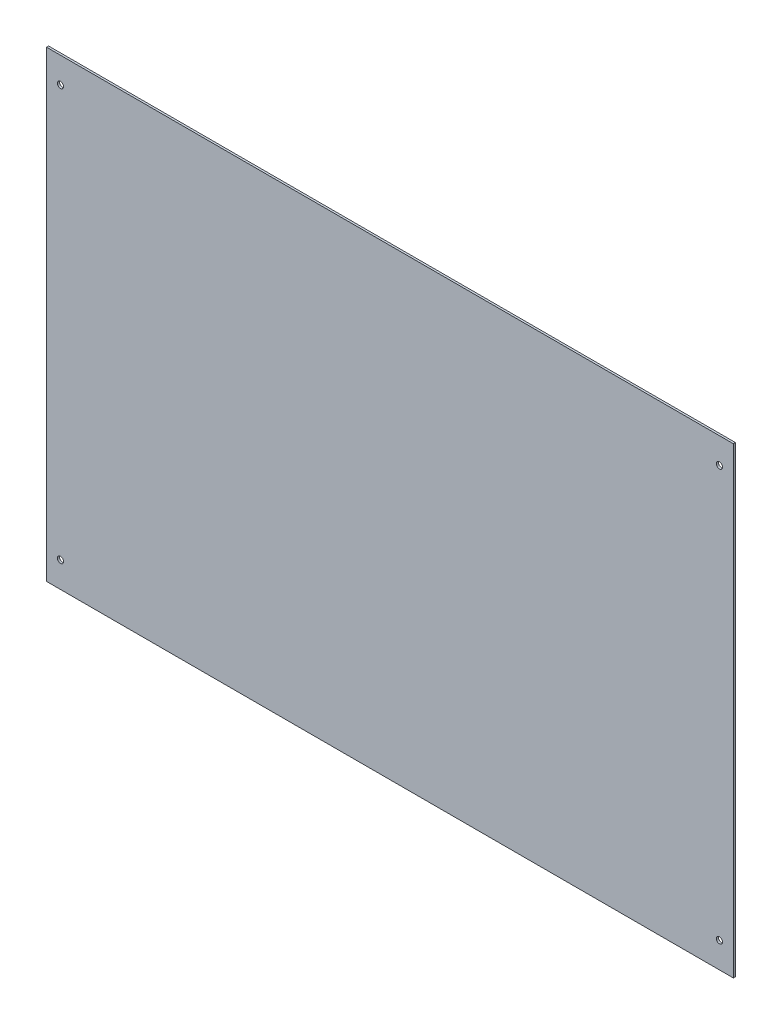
SolidWorks part; units mm, degrees
ref_plane "Front Plane" through (0, 0, 0) normal (0, 0, 1) x (1, 0, 0)
ref_plane "Top Plane" through (0, 0, 0) normal (0, 1, 0) x (1, 0, 0)
ref_plane "Right Plane" through (0, 0, 0) normal (1, 0, 0) x (0, 0, -1)
sketch "Sketch1" plane through (0, 0, 0) normal (0, 0, 1) x (1, 0, 0)
  line L1 (334, -225) -> (-334, -225)
  line L2 (334, -225) -> (334, 225)
  line L3 (334, 225) -> (-334, 225)
  line L4 (-334, -225) -> (-334, 225)
  line L5 (334, -225) -> (-334, 225) construction
  line L6 (334, 225) -> (-334, -225) construction
  point P0 (0, 0)
  dimension "D1" = 668
  dimension "D2" = 450
extrude "Extrude1" add sketch "Sketch1" along normal blind 2
sketch "Sketch3" plane through (0, 0, 2) normal (0, 0, 1) x (1, 0, 0)
  circle A0 centre (-320.427, 200) radius 3
  circle A1 centre (-320.427, -200) radius 3
  circle A2 centre (320.427, -200) radius 3
  circle A3 centre (320.427, 200) radius 3
  dimension "D1" = 6
extrude "Cut-Extrude1" cut sketch "Sketch3" against normal through all
sketch "Sketch5"
extrude "Extrude4" cut sketch "Sketch5" against normal blind 1
